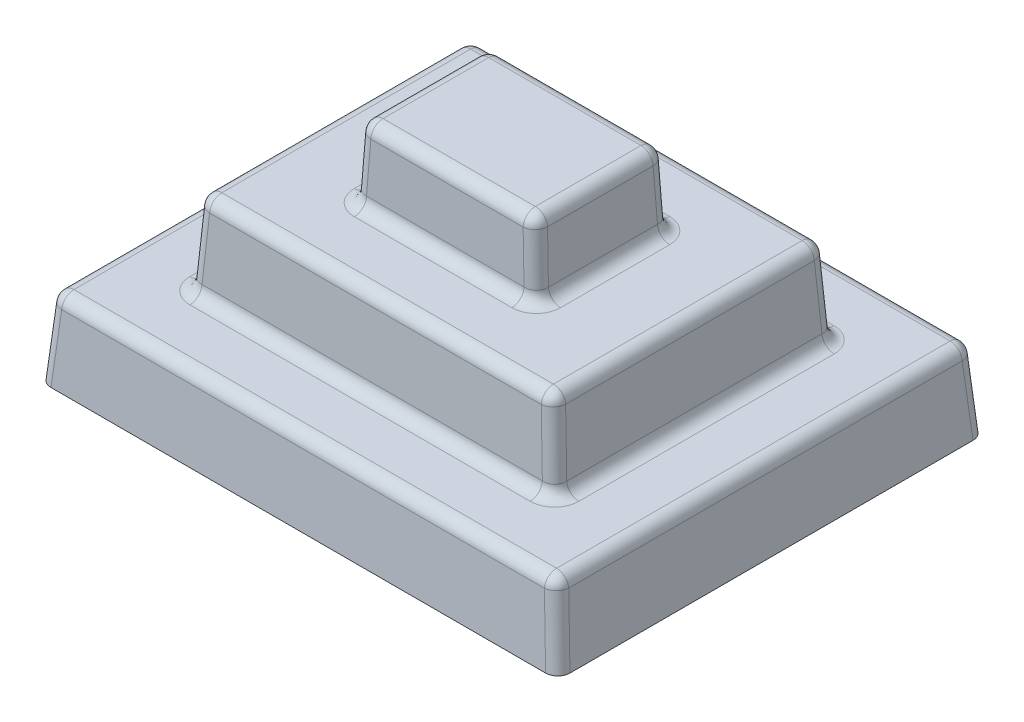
SolidWorks part; units mm, degrees
ref_plane "Front" through (0, 0, 0) normal (0, 0, 1) x (1, 0, 0)
ref_plane "Top" through (0, 0, 0) normal (0, 1, 0) x (1, 0, 0)
ref_plane "Right" through (0, 0, 0) normal (1, 0, 0) x (0, 0, -1)
sketch "Sketch1" plane through (0, 0, 0) normal (0, 1, 0) x (1, 0, 0)
  line L1 (-42.5, 35) -> (42.5, 35)
  line L2 (-42.5, 35) -> (-42.5, -35)
  line L3 (-42.5, -35) -> (42.5, -35)
  line L4 (42.5, 35) -> (42.5, -35)
  line L5 (-42.5, 35) -> (42.5, -35) construction
  line L6 (-42.5, -35) -> (42.5, 35) construction
  point P0 (0, 0)
  dimension "D1" = 85
  dimension "D2" = 70
extrude "Boss-Extrude1" add sketch "Sketch1" along normal blind 13
sketch "Sketch2" plane through (0, 13, 0) normal (0, 1, 0) x (1, 0, 0)
  line L1 (-30, 23) -> (30, 23)
  line L2 (-30, 23) -> (-30, -23)
  line L3 (-30, -23) -> (30, -23)
  line L4 (30, 23) -> (30, -23)
  line L5 (-30, 23) -> (30, -23) construction
  line L6 (-30, -23) -> (30, 23) construction
  point P0 (0, 0)
  dimension "D1" = 60
  dimension "D2" = 46
extrude "Boss-Extrude2" add sketch "Sketch2" along normal blind 14
sketch "Sketch3" plane through (0, 27, 0) normal (0, 1, 0) x (1, 0, 0)
  line L1 (-15, 11) -> (15, 11)
  line L2 (-15, 11) -> (-15, -11)
  line L3 (-15, -11) -> (15, -11)
  line L4 (15, 11) -> (15, -11)
  line L5 (-15, 11) -> (15, -11) construction
  line L6 (-15, -11) -> (15, 11) construction
  point P0 (0, 0)
  dimension "D1" = 30
  dimension "D2" = 22
extrude "Boss-Extrude3" add sketch "Sketch3" along normal blind 12
draft "Draft1" type of draft neutral plane draft angle 5 faces to draft 2 parameters "D1"=5
draft "Draft2" type of draft neutral plane draft angle 4 faces to draft 2 parameters "D1"=4
draft "Draft3" type of draft neutral plane draft angle 3 faces to draft 2 parameters "D1"=3
draft "Draft4" type of draft neutral plane draft angle 4 faces to draft 2 parameters "D1"=4
draft "Draft5" type of draft neutral plane draft angle 3 faces to draft 2 parameters "D1"=3
draft "Draft6" type of draft neutral plane draft angle 2 faces to draft 2 parameters "D1"=2
fillet "Fillet1" radius 2 32 edges at (-30, 13, 0) (0, 13, 23) (0, 13, -23) (30, 13, 0) (0, 27, -11) (0, 39, -10.581) (0, 27, 11) (0, 39, 10.581) (-15, 27, 0) (-14.3711, 39, 0) (15, 27, 0) (14.3711, 39, 0) (0, 27, 22.2663) (-29.021, 27, 0) (0, 27, -22.2663) (29.021, 27, 0) (0, 13, 34.091) (-41.3626, 13, 0) (0, 13, -34.091) (41.3626, 13, 0) (-14.6856, 33, -10.7905) (-14.6856, 33, 10.7905) (14.6856, 33, -10.7905) (14.6856, 33, 10.7905) (-29.5105, 20, -22.6331) (-29.5105, 20, 22.6331) (29.5105, 20, 22.6331) (29.5105, 20, -22.6331) (-41.9313, 6.5, 34.5455) (-41.9313, 6.5, -34.5455) (41.9313, 6.5, -34.5455) (41.9313, 6.5, 34.5455)
shell "Shell1" thickness 0.5
sketch "Sketch5" plane through (0, 26.5, 0) normal (0, -1, 0) x (1, 0, 0)
  line L0 (0, 10.4329) -> (0, -10.1487)
  line L1 (-14.4014, 0) -> (14.4014, 0)
  line L2 (14.4014, 8.9362) -> (14.4014, -8.9362) construction
  line L3 (-14.4014, -8.9362) -> (-14.4014, 8.9362) construction
  line L4 (-12.8998, 10.4329) -> (12.8998, 10.4329) construction
  line L5 (-12.4732, -10.1487) -> (12.4732, -10.1487) construction
  point P5 (0, 0)
  point P8 (0, 0)
  point P11 (0, 0)
  point P14 (0, 0)
rib "Rib1" sketch "Sketch5" sketch "Sketch5" thickness 0.5 extrusion direction normal to sketch draft on no parameters "D1"=0.5
